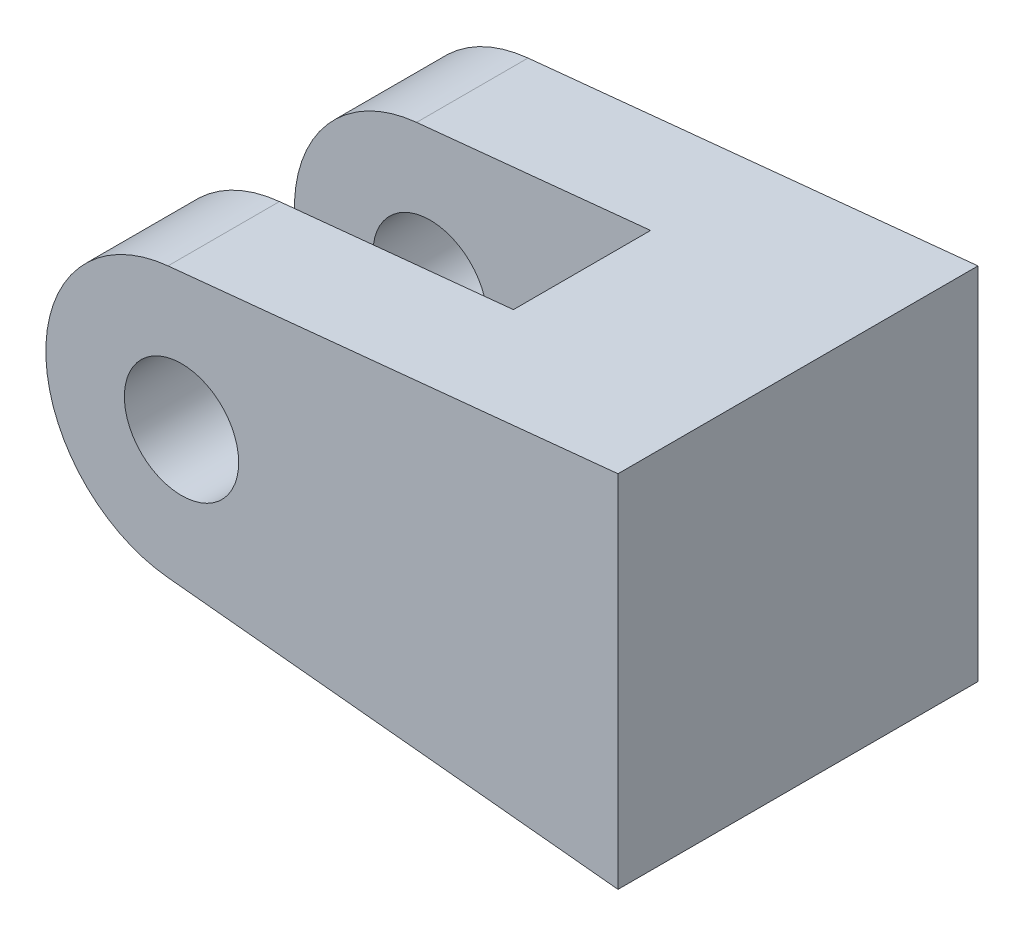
SolidWorks part; units mm, degrees
ref_plane "Front Plane" through (0, 0, 0) normal (0, 0, 1) x (1, 0, 0)
ref_plane "Top Plane" through (0, 0, 0) normal (0, 1, 0) x (1, 0, 0)
ref_plane "Right Plane" through (0, 0, 0) normal (1, 0, 0) x (0, 0, -1)
sketch "Sketch1" plane through (0, 0, 0) normal (0, 0, 1) x (1, 0, 0)
  line L0 (94.2301, 2.2161) -> (94.2301, -17.7839)
  line L1 (94.2301, 2.2161) -> (69.2301, -0.2839)
  line L2 (94.2301, -17.7839) -> (69.2301, -15.2839)
  line L3 (94.2301, -7.7839) -> (29.8059, -7.7839) construction
  arc A0 (69.2301, -0.2839) -> (69.2301, -15.2839) centre (69.9801, -7.7839) ccw
  circle A2 centre (69.9801, -7.7839) radius 3.175
  dimension "D4" = 6.35
  dimension "D1" = 20
  dimension "D2" = 25
  dimension "D3" = 25
  dimension "D5" = 15
extrude "Extrude1" add sketch "Sketch1" along normal blind 20
sketch "Sketch2" plane through (0, 0, 0) normal (0, 1, 0) x (1, 0, 0)
  line L0 (94.2301, -20) -> (94.2301, 0) construction
  line L1 (82.2301, -6.19) -> (57.8841, -6.19)
  line L2 (82.2301, -6.19) -> (82.2301, -13.81)
  line L3 (82.2301, -13.81) -> (57.8841, -13.81)
  line L4 (57.8841, -6.19) -> (57.8841, -13.81)
  line L5 (94.2301, -20) -> (94.2301, 0) construction
  line L6 (94.2301, -10) -> (39.4156, -10) construction
  point P8 (82.2301, -10)
  dimension "D1" = 7.62
  dimension "D2" = 12
extrude "Cut-Extrude1" cut sketch "Sketch2" against normal through all and the other way through all
